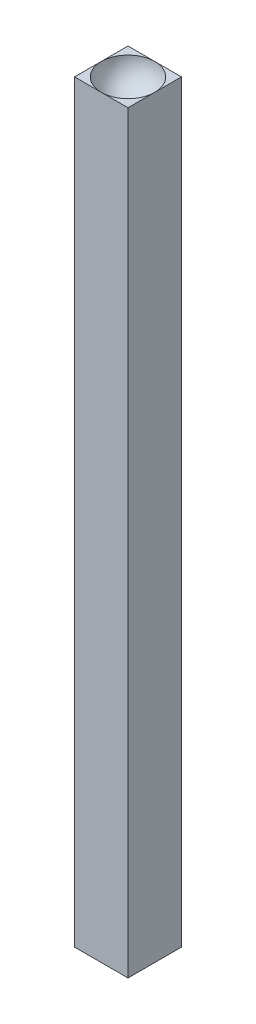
SolidWorks part; units mm, degrees
ref_plane "Front Plane" through (0, 0, 0) normal (0, 0, 1) x (1, 0, 0)
ref_plane "Top Plane" through (0, 0, 0) normal (0, 1, 0) x (1, 0, 0)
ref_plane "Right Plane" through (0, 0, 0) normal (1, 0, 0) x (0, 0, -1)
sketch "Sketch1" plane through (0, 0, 0) normal (0, 1, 0) x (1, 0, 0)
  line L1 (0, 0) -> (10, 0)
  line L2 (0, 0) -> (0, 10)
  line L3 (0, 10) -> (10, 10)
  line L4 (10, 0) -> (10, 10)
  dimension "D1" = 10
  dimension "D2" = 10
extrude "Boss-Extrude1" add sketch "Sketch1" along normal blind 141
ref_plane "Plane1" through (0, 0, -5) normal (0, 0, 1) x (1, 0, 0)
sketch "Sketch4" plane through (0, 0, -5) normal (0, 0, 1) x (1, 0, 0)
  line L0 (0, 141) -> (10, 141) construction
  line L1 (5, 141) -> (5, 136)
  line L2 (5, 141) -> (10, 141)
  arc A0 (5, 136) -> (10, 141) centre (5, 141) ccw
revolve "Cut-Revolve1" cut sketch "Sketch4" angle 360 about L1
